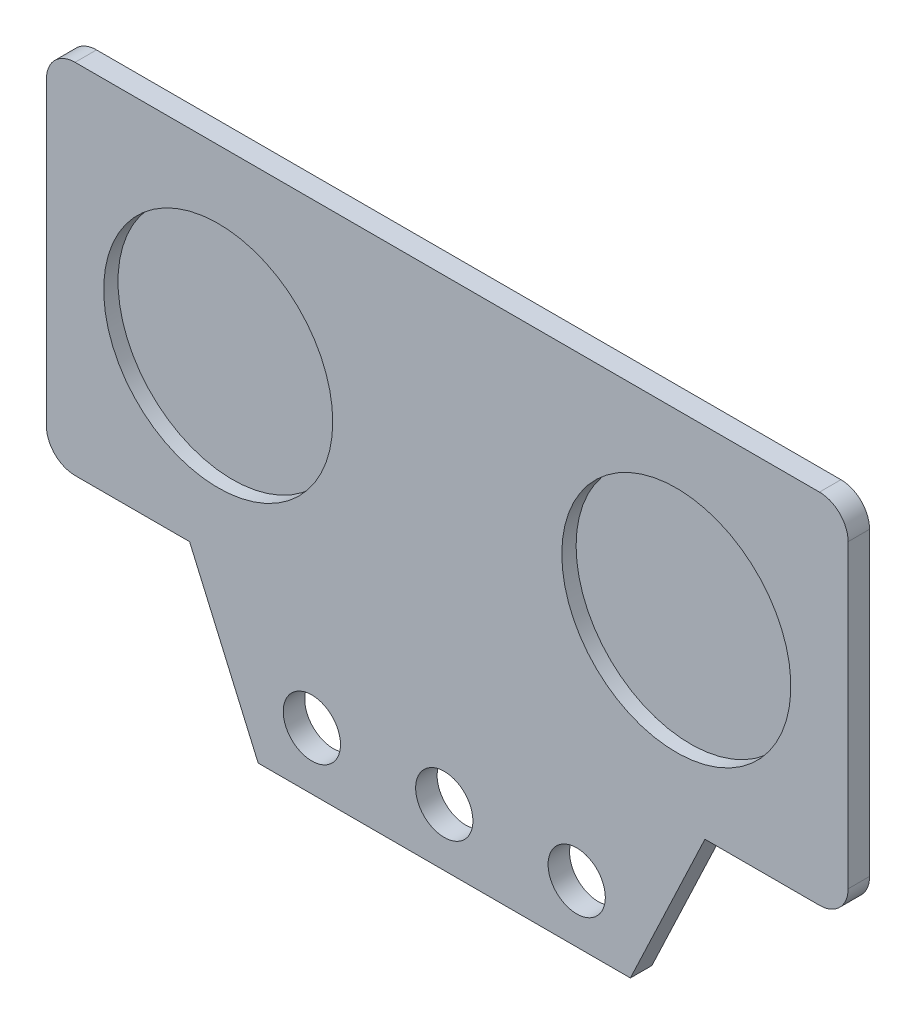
SolidWorks part; units mm, degrees
ref_plane "Plan de face" through (0, 0, 0) normal (0, 0, 1) x (1, 0, 0)
ref_plane "Plan de dessus" through (0, 0, 0) normal (0, 1, 0) x (1, 0, 0)
ref_plane "Plan de droite" through (0, 0, 0) normal (1, 0, 0) x (0, 0, -1)
sketch "Esquisse1" plane through (0, 0, 0) normal (0, 0, 1) x (1, 0, 0)
  line L0 (0, 2) -> (0, 23)
  line L1 (2, 25) -> (54, 25)
  line L2 (56, 23) -> (56, 2)
  line L3 (54, 0) -> (46, 0)
  line L4 (46, 0) -> (40.7916, -11)
  line L5 (40.7916, -11) -> (14.7916, -11)
  line L6 (14.7916, -11) -> (10, 0)
  line L7 (10, 0) -> (2, 0)
  arc A0 (0, 2) -> (2, 0) centre (2, 2) ccw
  arc A1 (56, 2) -> (54, 0) centre (54, 2) cw
  arc A2 (54, 25) -> (56, 23) centre (54, 23) cw
  arc A3 (0, 23) -> (2, 25) centre (2, 23) cw
  circle A4 centre (18.5416, -7) radius 2
  circle A5 centre (37.0416, -7) radius 2
  circle A6 centre (27.7916, -7) radius 2
  point P11 (0, 0)
  point P16 (56, 25)
  point P19 (0, 25)
  dimension "D3" = 2
  dimension "D8" = 18.5
  dimension "D1" = 56
  dimension "D2" = 25
  dimension "D4" = 10
  dimension "D5" = 10
  dimension "D6" = 26
  dimension "D7" = 11
  dimension "D9" = 9.25
  dimension "D10" = 3.75
  dimension "D11" = 4
extrude "Boss.-Extru.1" add sketch "Esquisse1" along normal blind 1.5
sketch "Esquisse2" plane through (0, 0, 1.5) normal (0, 0, 1) x (1, 0, 0)
  line L0 (28, 25) -> (28, -15.9607) construction
  line L1 (54, 25) -> (2, 25) construction
  line L2 (0, 23) -> (0, 2) construction
  circle A0 centre (12, 12.2509) radius 8
  circle A1 centre (44, 12.2509) radius 8
  dimension "D1" = 12
extrude "Enlèv. mat.-Extru.1" cut sketch "Esquisse2" against normal blind 1
